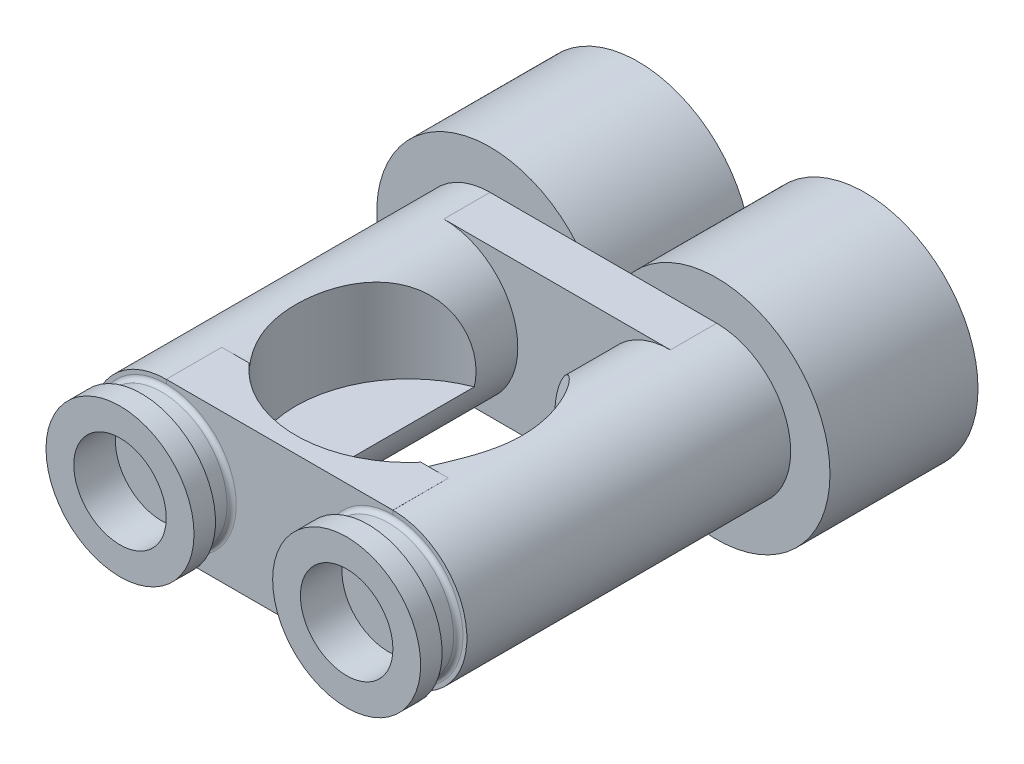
SolidWorks part; units mm, degrees
ref_plane "Vorne" through (0, 0, 0) normal (0, 0, 1) x (1, 0, 0)
ref_plane "Oben" through (0, 0, 0) normal (0, 1, 0) x (1, 0, 0)
ref_plane "Rechts" through (0, 0, 0) normal (1, 0, 0) x (0, 0, -1)
sketch "Skizze1" plane through (0, 0, 0) normal (0, 0, 1) x (1, 0, 0)
  circle A0 centre (0, 0) radius 2.45
  dimension "D1" = 4.9
extrude "Linear austragen1" add sketch "Skizze1" along normal blind 3.2
sketch "Skizze2" plane through (0, 0, 3.2) normal (0, 0, 1) x (1, 0, 0)
  line L0 (4.9, 0) -> (0, 0) construction
  circle A0 centre (4.9, 0) radius 2.45
  dimension "D2" = 4.9
  dimension "D1" = 4.9
extrude "Linear austragen2" add sketch "Skizze2" against normal blind 3.2
sketch "Skizze3" plane through (0, 0, 3.2) normal (0, 0, 1) x (1, 0, 0)
  circle A0 centre (0, 0) radius 1.6
  circle A1 centre (4.9, 0) radius 1.6
extrude "Linear austragen3" add sketch "Skizze3" along normal blind 8
ref_plane "Ebene1" through (0, 0, 10.2) normal (0, 0, 1) x (1, 0, 0)
sketch "Skizze6" plane through (0, 0, 10.2) normal (0, 0, 1) x (1, 0, 0)
  line L1 (0, -1.6) -> (4.9, -1.6)
  line L2 (0, -1.6) -> (0, 1.6)
  line L3 (0, 1.6) -> (4.9, 1.6)
  line L4 (4.9, -1.6) -> (4.9, 1.6)
  circle A2 centre (0, 0) radius 1.6 construction
  point P6 (4.9, 0)
extrude "Linear austragen16" add sketch "Skizze6" against normal blind 1.2 separate body
sketch "Skizze7" plane through (0, 0, 3.2) normal (0, 0, 1) x (1, 0, 0)
  line L1 (0, 1.6) -> (4.9, 1.6)
  line L2 (0, 1.6) -> (0, -1.6)
  line L3 (0, -1.6) -> (4.9, -1.6)
  line L4 (4.9, 1.6) -> (4.9, -1.6)
  circle A0 centre (0, 0) radius 1.6 construction
extrude "Linear austragen18" add sketch "Skizze7" along normal blind 1 separate body
sketch "Skizze8" plane through (0, 0, 11.2) normal (0, 0, 1) x (1, 0, 0)
  circle A0 centre (0, 0) radius 1
  circle A1 centre (4.9, 0) radius 1
  dimension "D1" = 2
  dimension "D2" = 2
extrude "Schnitt-Linear austragen1" cut sketch "Skizze8" against normal blind 0.9
sketch "Skizze10" plane through (0, 0, 0) normal (1, 0, 0) x (0, 0, -1)
  line L0 (0, 0) -> (-11.9012, 0) construction
  line L1 (-10.2, 1.6) -> (-10.7354, 1.6)
  line L2 (-10.2, 1.6) -> (-10.2, 1.4138)
  line L3 (-10.2, 1.4138) -> (-10.7354, 1.4138)
  line L4 (-10.7354, 1.6) -> (-10.7354, 1.4138)
revolve "Schnitt-Rotation1" cut sketch "Skizze10" angle 360 about L0
fillet "Verrundung1" radius 0.1 2 edges at (-1.4138, 0, 10.2) (-1.4138, 0, 10.7354)
ref_plane "Ebene2" through (4.9, 0, 0) normal (1, 0, 0) x (0, 0, -1)
sketch "Skizze11" plane through (4.9, 0, 0) normal (1, 0, 0) x (0, 0, -1)
  line L0 (0, 0) -> (-11.2, 0) construction
  line L1 (-11.2, 1.6) -> (-11.2, -1.6) construction
  line L2 (-10.2, -1.6) -> (-10.2, 1.6) construction
  line L3 (-10.7354, 1.6) -> (-10.2, 1.6)
  line L4 (-10.7354, 1.6) -> (-10.7354, 1.4138)
  line L5 (-10.7354, 1.4138) -> (-10.2, 1.4138)
  line L6 (-10.2, 1.6) -> (-10.2, 1.4138)
revolve "Schnitt-Rotation2" cut sketch "Skizze11" angle 360 about L0
fillet "Verrundung2" radius 0.1 2 edges at (3.4862, 0, 10.7354) (3.4862, 0, 10.2)
sketch "Skizze12" plane through (0, 1.6, 0) normal (0, 1, 0) x (-1, 0, 0)
  line L0 (-4.9, 4.915) -> (0, 4.915) construction
  line L1 (-4.9, 2.695) -> (-4.9, -2.695) construction
  line L2 (0, 2.695) -> (0, -2.695) construction
  line L3 (-2.45, 4.915) -> (-2.45, 11.6113) construction
  line L4 (-4.9, 4.2) -> (0, 4.2) construction
  circle A0 centre (-2.45, 7.4) radius 2.45
  point P10 (-2.45, 4.2)
  dimension "D1" = 3.2
  dimension "D2" = 4.9
extrude "Schnitt-Linear austragen2" cut sketch "Skizze12" against normal blind 1.9
